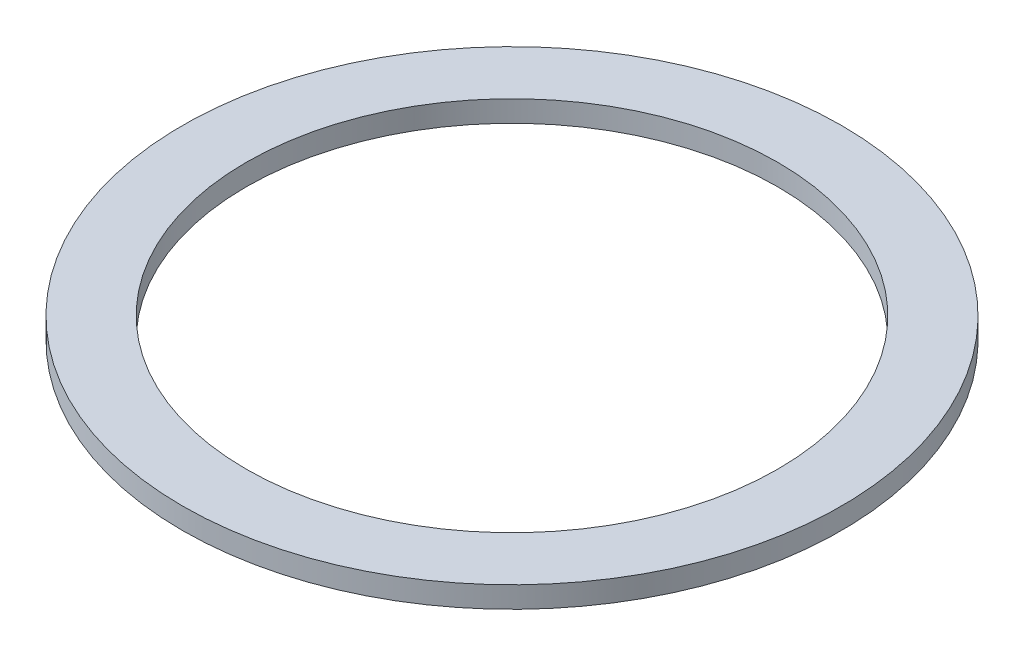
SolidWorks part; units mm, degrees
ref_plane "Front Plane" through (0, 0, 0) normal (0, 0, 1) x (1, 0, 0)
ref_plane "Top Plane" through (0, 0, 0) normal (0, 1, 0) x (1, 0, 0)
ref_plane "Right Plane" through (0, 0, 0) normal (1, 0, 0) x (0, 0, -1)
sketch "Sketch1" plane through (0, 0, 0) normal (0, 1, 0) x (1, 0, 0)
  circle A0 centre (0, 0) radius 12.4
  circle A1 centre (0, 0) radius 10
  dimension "D1" = 24.8
  dimension "D2" = 20
extrude "Boss-Extrude1" add sketch "Sketch1" along normal blind 0.8
